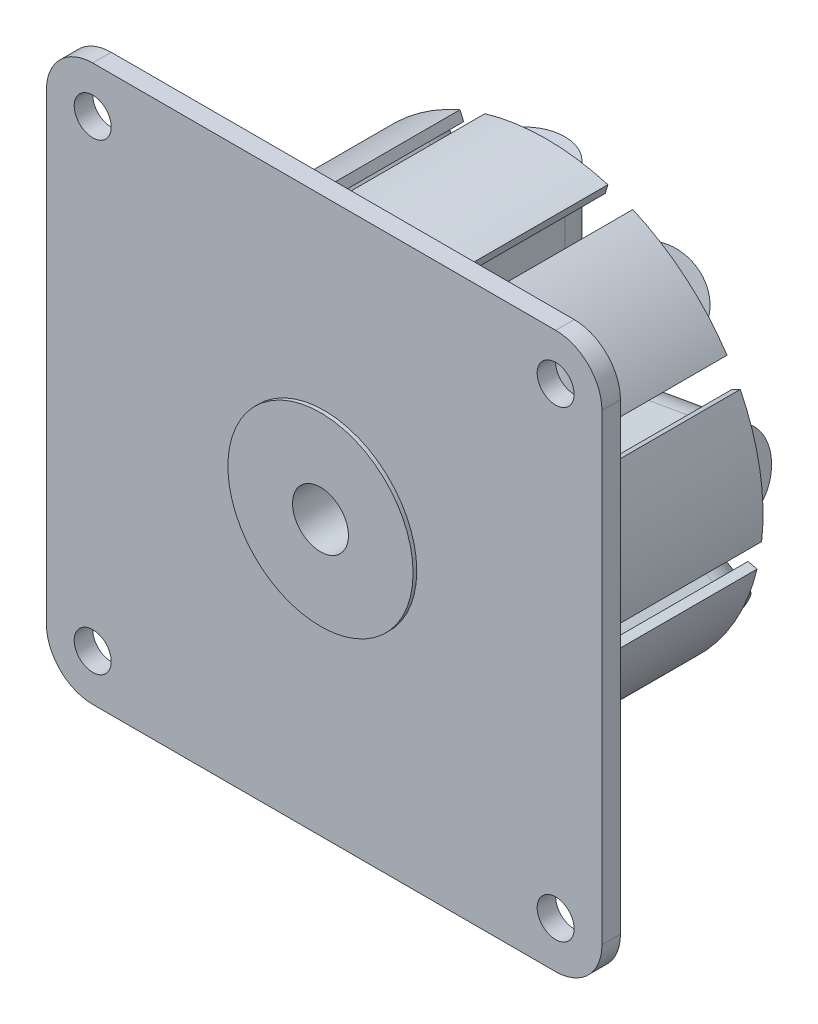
SolidWorks part; units mm, degrees
ref_plane "Plan de face" through (0, 0, 0) normal (0, 0, 1) x (1, 0, 0)
ref_plane "Plan de dessus" through (0, 0, 0) normal (0, 1, 0) x (1, 0, 0)
ref_plane "Plan de droite" through (0, 0, 0) normal (1, 0, 0) x (0, 0, -1)
sketch "Esquisse1" plane through (0, 0, 0) normal (0, 0, 1) x (1, 0, 0)
  circle A0 centre (0, 0) radius 1.51
  circle A1 centre (0, 0) radius 6.25
extrude "Extrusion1" add sketch "Esquisse1" against normal blind 12
sketch "Esquisse2" plane through (0, 0, 0) normal (0, 0, 1) x (1, 0, 0)
  line L1 (-12.5, 15) -> (12.5, 15)
  line L2 (-15, 12.5) -> (-15, -12.5)
  line L3 (-12.5, -15) -> (12.5, -15)
  line L4 (15, 12.5) -> (15, -12.5)
  arc A0 (-12.5, 15) -> (-15, 12.5) centre (-12.5, 12.5) ccw
  arc A1 (12.5, 15) -> (15, 12.5) centre (12.5, 12.5) cw
  arc A2 (12.5, -15) -> (15, -12.5) centre (12.5, -12.5) ccw
  arc A3 (-15, -12.5) -> (-12.5, -15) centre (-12.5, -12.5) ccw
  circle A7 centre (12.5, 12.5) radius 1
  circle A8 centre (-12.5, 12.5) radius 1
  circle A9 centre (-12.5, -12.5) radius 1
  circle A10 centre (12.5, -12.5) radius 1
  dimension "D1" = 2.5
extrude "Extrusion2" add sketch "Esquisse2" against normal blind 1
sketch "Esquisse3" plane through (0, 0, 0) normal (0, 0, 1) x (1, 0, 0)
  circle A0 centre (0, 0) radius 5
extrude "Extrusion3" add sketch "Esquisse3" along normal blind 0.2
sketch "Esquisse4" plane through (0, 0, 0.2) normal (0, 0, 1) x (1, 0, 0)
  circle A0 centre (0, 0) radius 1.51
extrude "Enlèv. mat.-Extru.1" cut sketch "Esquisse4" against normal through all
ref_plane "Plan1" through (0, 5.5, 0) normal (0, 1, 0) x (-1, 0, 0)
sketch "Esquisse5" plane through (0, 5.5, 0) normal (0, 1, 0) x (-1, 0, 0)
  line L1 (-0.01, -2) -> (0.01, -2)
  line L2 (-8.3529, -2) -> (9.1577, -2) construction
  line L3 (-7.1596, -13) -> (7.0764, -13) construction
  line L4 (-2.2, -1.5154) -> (-2.2, -14.3362) construction
  line L5 (2.2, -1.5154) -> (2.2, -14.3362) construction
  line L6 (-2.2, -4.19) -> (-2.2, -10.81)
  line L7 (-0.01, -13) -> (0.01, -13)
  line L8 (2.2, -4.19) -> (2.2, -10.81)
  arc A0 (-0.01, -2) -> (-2.2, -4.19) centre (-0.01, -4.19) ccw
  arc A1 (0.01, -2) -> (2.2, -4.19) centre (0.01, -4.19) cw
  arc A2 (0.01, -13) -> (2.2, -10.81) centre (0.01, -10.81) ccw
  arc A3 (-2.2, -10.81) -> (-0.01, -13) centre (-0.01, -10.81) ccw
  point P15 (-2.2, -2)
  point P17 (-2.2, -2)
  point P18 (-2.2, -2)
  point P22 (2.2, -13)
  point P23 (2.2, -13)
  point P24 (2.2, -13)
  dimension "D1" = 2.19
extrude "Extrusion4" add sketch "Esquisse5" along normal blind 5.8
pattern_circular "Répétition circulaire1" count 9 every 40 about axis through (0, 0, 0) along (0, 0, 1) of "Extrusion4"
sketch "Esquisse6" plane through (0, 0, -12) normal (0, 0, -1) x (-1, 0, 0)
  line L0 (-3.1798, 10.7391) -> (-3.3218, 11.2185)
  line L1 (0, 0) -> (0, 3.9341) construction
  line L2 (3.1798, 10.7391) -> (3.3218, 11.2185)
  arc A0 (3.3218, 11.2185) -> (-3.3218, 11.2185) centre (0, 0) ccw
  arc A1 (3.1798, 10.7391) -> (-3.1798, 10.7391) centre (0, 0) ccw
extrude "Extrusion5" add sketch "Esquisse6" against normal blind 9
pattern_circular "Répétition circulaire2" count 9 every 40 about axis through (0, 0, 0) along (0, 0, 1) of "Extrusion5"
